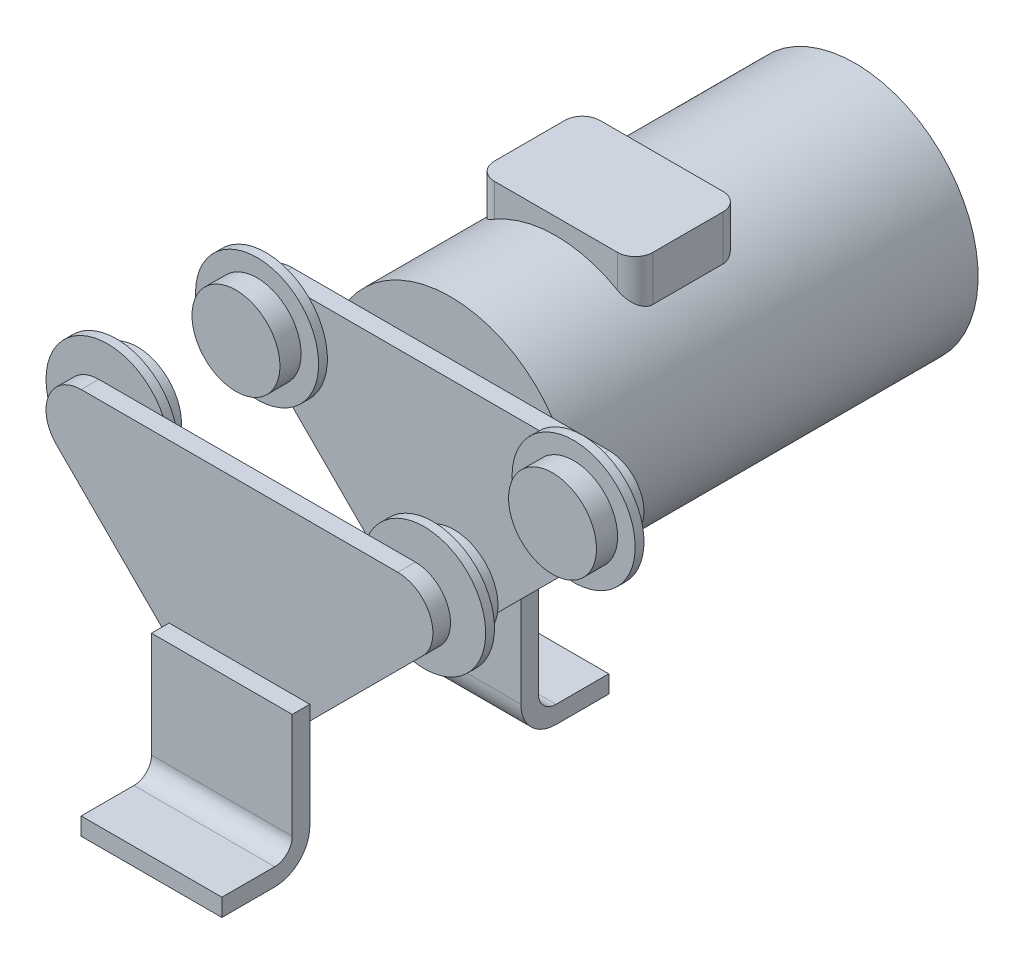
SolidWorks part; units mm, degrees
ref_plane "Plan de face" through (0, 0, 0) normal (0, 0, 1) x (1, 0, 0)
ref_plane "Plan de dessus" through (0, 0, 0) normal (0, 1, 0) x (1, 0, 0)
ref_plane "Plan de droite" through (0, 0, 0) normal (1, 0, 0) x (0, 0, -1)
sketch "Esquisse1" plane through (0, 0, 0) normal (0, 0, 1) x (1, 0, 0)
  line L0 (-90, 0) -> (90, 0)
  line L1 (104.1421, -34.1421) -> (14.1421, -124.1421)
  line L2 (-14.1421, -124.1421) -> (-104.1421, -34.1421)
  arc A0 (14.1421, -124.1421) -> (-14.1421, -124.1421) centre (0, -110) cw
  arc A1 (90, 0) -> (104.1421, -34.1421) centre (90, -20) cw
  arc A2 (-104.1421, -34.1421) -> (-90, 0) centre (-90, -20) cw
  point P6 (0, -138.2843)
  dimension "D1" = 20
  dimension "D2" = 180
extrude "Boss.-Extru.1" add sketch "Esquisse1" along normal blind 10
sketch "Esquisse3" plane through (0, 0, 0) normal (0, 0, -1) x (-1, 0, 0)
  circle A0 centre (-90, -20) radius 10
  circle A1 centre (90, -20) radius 10
  arc A2 (-90, 0) -> (-104.1421, -34.1421) centre (-90, -20) ccw construction
  arc A3 (104.1421, -34.1421) -> (90, 0) centre (90, -20) ccw construction
  dimension "D1" = 20
extrude "Boss.-Extru.2" add sketch "Esquisse3" along normal blind 5
sketch "Esquisse4" plane through (0, 0, -5) normal (0, 0, -1) x (-1, 0, 0)
  circle A0 centre (-90, -20) radius 35
  circle A1 centre (90, -20) radius 35
  dimension "D1" = 70
extrude "Boss.-Extru.3" add sketch "Esquisse4" along normal blind 5
sketch "Esquisse5" plane through (0, 0, -10) normal (0, 0, -1) x (-1, 0, 0)
  circle A0 centre (-90, -20) radius 25
  circle A1 centre (90, -20) radius 25
  dimension "D1" = 50
extrude "Boss.-Extru.4" add sketch "Esquisse5" along normal blind 12
sketch "Esquisse6" plane through (0, 0, 0) normal (0, 0, -1) x (-1, 0, 0)
  circle A0 centre (0, -110) radius 15
  arc A1 (-14.1421, -124.1421) -> (14.1421, -124.1421) centre (0, -110) ccw construction
  dimension "D1" = 30
extrude "Boss.-Extru.5" add sketch "Esquisse6" along normal blind 100
ref_plane "Plan1" through (0, 0, -50) normal (0, 0, -1) x (-1, 0, 0)
mirror "Symétrie3" about plane through (0, 0, -50) normal (0, 0, -1) of "Boss.-Extru.4", "Boss.-Extru.2", "Boss.-Extru.3", "Boss.-Extru.1"
sketch "Esquisse7" plane through (0, 0, -110) normal (0, 0, -1) x (-1, 0, 0)
  line L0 (-14.1421, -124.1421) -> (-104.1421, -34.1421) construction
  line L1 (104.1421, -34.1421) -> (14.1421, -124.1421) construction
  circle A0 centre (0, -39.2893) radius 70
  dimension "D1" = 140
extrude "Boss.-Extru.6" add sketch "Esquisse7" along normal blind 230
sketch "Esquisse8" plane through (0, 0, 10) normal (0, 0, 1) x (1, 0, 0)
  line L0 (0, 0) -> (0, -90) construction
  line L1 (-40, -90) -> (40, -90)
  line L2 (-40, -90) -> (-40, -170)
  line L3 (-40, -170) -> (40, -170)
  line L4 (40, -90) -> (40, -170)
  line L5 (57.934, 0) -> (-57.934, 0) construction
  dimension "D1" = 80
  dimension "D2" = 80
  dimension "D3" = 90
extrude "Boss.-Extru.7" add sketch "Esquisse8" along normal blind 10
sketch "Esquisse9" plane through (0, 0, 20) normal (0, 0, 1) x (1, 0, 0)
  line L0 (40, -170) -> (40, -90) construction
  line L1 (-40, -170) -> (40, -170)
  line L2 (-40, -170) -> (-40, -160)
  line L3 (-40, -160) -> (40, -160)
  line L4 (40, -170) -> (40, -160)
  dimension "D1" = 10
extrude "Boss.-Extru.8" add sketch "Esquisse9" along normal blind 40
fillet "Congé1" radius 10 1 edges
fillet "Congé2" radius 20 1 edges at (0, -170, 10)
mirror "Symétrie4" about plane through (0, 0, -50) normal (0, 0, -1) of "Congé2", "Congé1", "Boss.-Extru.8", "Boss.-Extru.7"
sketch "Esquisse10" plane through (0, 0, 0) normal (0, 1, 0) x (1, 0, 0)
  line L0 (0, 0) -> (0, 170) construction
  line L1 (-35, 230) -> (35, 230)
  line L2 (-45, 220) -> (-45, 180)
  line L3 (-35, 170) -> (35, 170)
  line L4 (45, 220) -> (45, 180)
  line L5 (57.934, 110) -> (-57.934, 110) construction
  arc A0 (35, 230) -> (45, 220) centre (35, 220) cw
  arc A1 (45, 180) -> (35, 170) centre (35, 180) cw
  arc A2 (-35, 170) -> (-45, 180) centre (-35, 180) cw
  arc A3 (-45, 220) -> (-35, 230) centre (-35, 220) cw
  dimension "D4" = 10
  dimension "D1" = 60
  dimension "D2" = 60
  dimension "D3" = 90
extrude "Boss.-Extru.9" add sketch "Esquisse10" along normal blind 40
